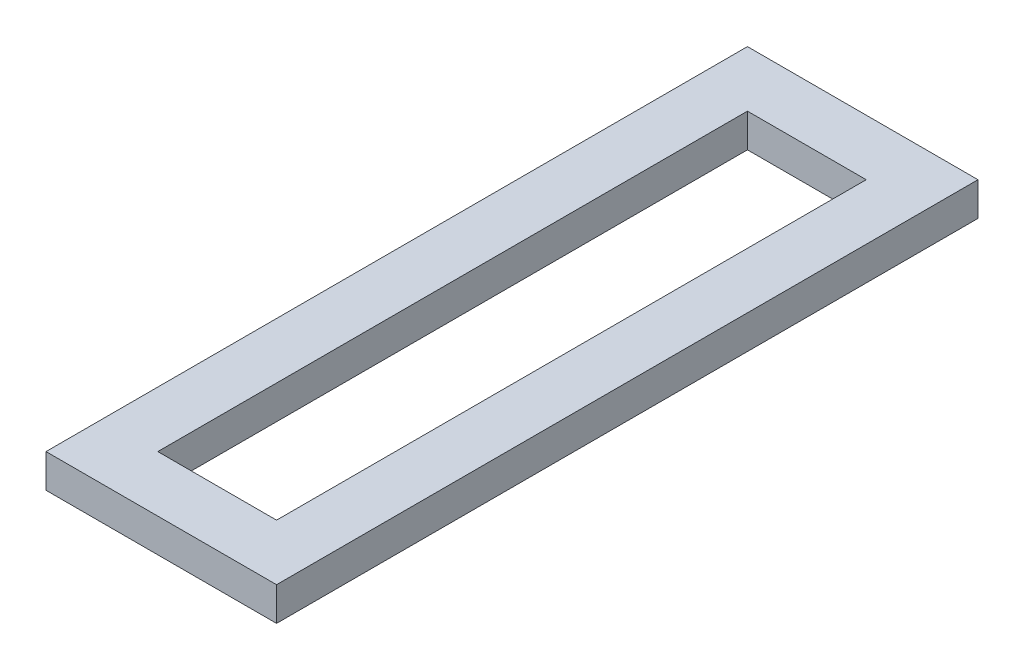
SolidWorks part; units mm, degrees
ref_plane "Front Plane" through (0, 0, 0) normal (0, 0, 1) x (1, 0, 0)
ref_plane "Top Plane" through (0, 0, 0) normal (0, 1, 0) x (1, 0, 0)
ref_plane "Right Plane" through (0, 0, 0) normal (1, 0, 0) x (0, 0, -1)
sketch "Sketch1" plane through (0, 0, 0) normal (0, 1, 0) x (1, 0, 0)
  line L0 (-212.5, 1055) -> (212.5, 1055)
  line L1 (-412.5, -1255) -> (412.5, -1255)
  line L2 (-412.5, -1255) -> (-412.5, 1255)
  line L3 (-412.5, 1255) -> (412.5, 1255)
  line L4 (412.5, -1255) -> (412.5, 1255)
  line L5 (-412.5, -1255) -> (412.5, 1255) construction
  line L6 (-412.5, 1255) -> (412.5, -1255) construction
  line L7 (212.5, -1055) -> (212.5, 1055)
  line L8 (-212.5, -1055) -> (212.5, -1055)
  line L9 (-212.5, -1055) -> (-212.5, 1055)
  point P0 (0, 0)
  dimension "D1" = 2510
  dimension "D2" = 825
  dimension "D3" = 200
extrude "Boss-Extrude1" add sketch "Sketch1" along normal blind 120
ref_plane "Plane1" through (0, 10, 0) normal (0, 1, 0) x (1, 0, 0)
sketch "Sketch5" plane through (0, 10, 0) normal (0, 1, 0) x (1, 0, 0)
  line L0 (412.5, -1255) -> (412.5, 1255) construction
  line L1 (-402.5, -1245) -> (402.5, -1245)
  line L2 (-402.5, -1245) -> (-402.5, 1245)
  line L3 (-402.5, 1245) -> (402.5, 1245)
  line L4 (402.5, -1245) -> (402.5, 1245)
  line L5 (-402.5, -1245) -> (402.5, 1245) construction
  line L6 (-402.5, 1245) -> (402.5, -1245) construction
  line L7 (412.5, 1255) -> (-412.5, 1255) construction
  line L8 (212.5, 1055) -> (-212.5, 1055) construction
  line L9 (222.5, -1065) -> (-222.5, -1065)
  line L10 (222.5, -1065) -> (222.5, 1065)
  line L11 (222.5, 1065) -> (-222.5, 1065)
  line L12 (-222.5, -1065) -> (-222.5, 1065)
  line L13 (222.5, -1065) -> (-222.5, 1065) construction
  line L14 (222.5, 1065) -> (-222.5, -1065) construction
  line L15 (212.5, -1055) -> (212.5, 1055) construction
  point P0 (0, 0)
  point P10 (0, 0)
  dimension "D1" = 10
  dimension "D2" = 10
  dimension "D3" = 10
  dimension "D4" = 10
extrude "Cut-Extrude1" cut sketch "Sketch5" along normal blind 100
